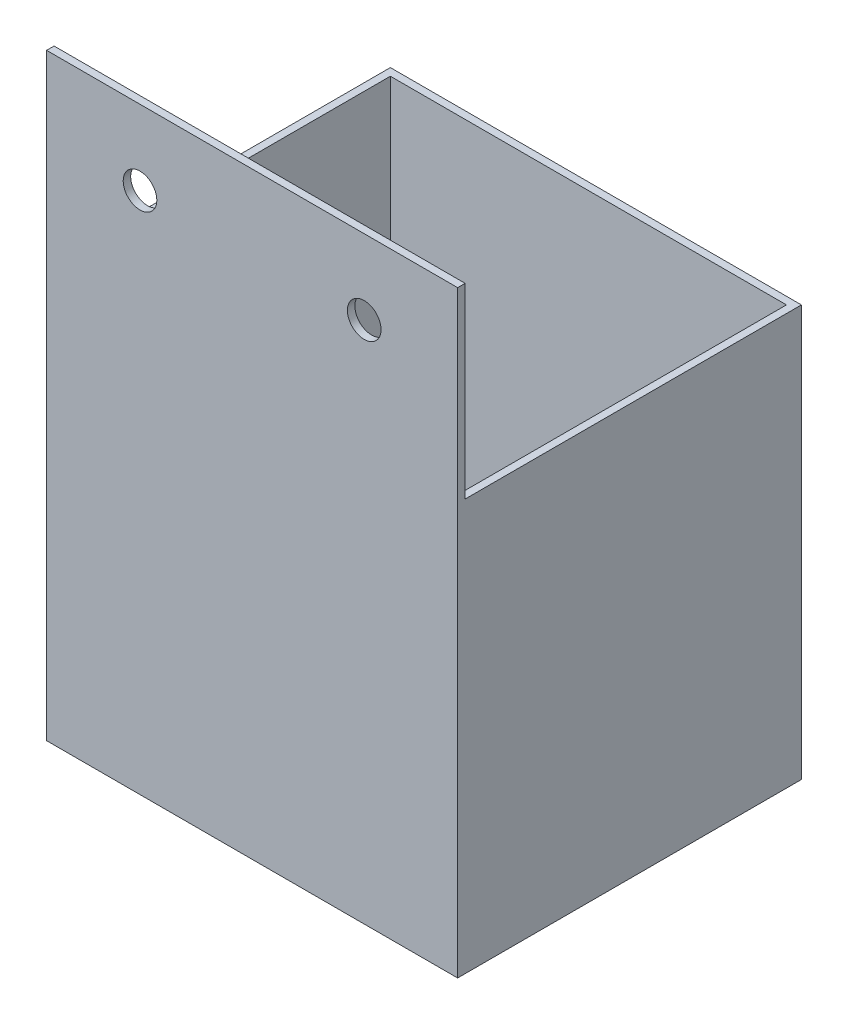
SolidWorks part; units mm, degrees
ref_plane "前视基准面" through (0, 0, 0) normal (0, 0, 1) x (1, 0, 0)
ref_plane "上视基准面" through (0, 0, 0) normal (0, 1, 0) x (1, 0, 0)
ref_plane "右视基准面" through (0, 0, 0) normal (1, 0, 0) x (0, 0, -1)
sketch "草图1" plane through (0, 0, 0) normal (0, 0, 1) x (1, 0, 0)
  line L0 (0, 0) -> (0, 80)
  line L1 (55, 0) -> (55, 80)
  line L2 (0, 0) -> (55, 0)
  line L3 (0, 80) -> (55, 80)
  circle A0 centre (12.5, 70) radius 2.25
  circle A1 centre (42.5, 70) radius 2.25
extrude "凸台-拉伸1" add sketch "草图1" along normal blind 46
sketch "草图2" plane through (55, 0, 0) normal (1, 0, 0) x (0, 0, -1)
  line L0 (-46, 0) -> (-46, 80)
  line L1 (0, 0) -> (0, 55)
  line L2 (-46, 0) -> (0, 0)
  line L3 (-45, 55) -> (0, 55)
  line L4 (-45, 55) -> (-45, 80)
  line L5 (-46, 80) -> (-45, 80)
extrude "切除-拉伸1" cut sketch "草图2" against normal through all flip side to cut
shell "抽壳1" thickness 1
